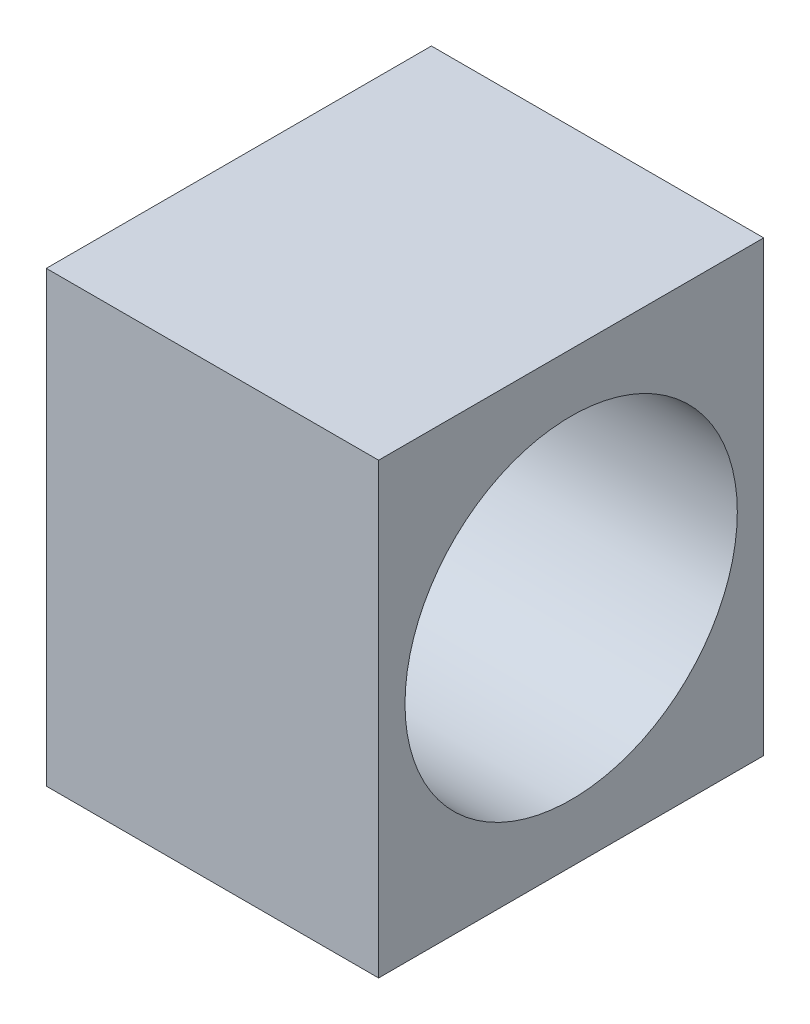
SolidWorks part; units mm, degrees
ref_plane "Front Plane" through (0, 0, 0) normal (0, 0, 1) x (1, 0, 0)
ref_plane "Top Plane" through (0, 0, 0) normal (0, 1, 0) x (1, 0, 0)
ref_plane "Right Plane" through (0, 0, 0) normal (1, 0, 0) x (0, 0, -1)
sketch "Sketch1" plane through (0, 0, 0) normal (0, 0, 1) x (1, 0, 0)
  line L1 (-27.636, 161.5249) -> (7.364, 161.5249)
  line L2 (-27.636, 161.5249) -> (-27.636, 208.7542)
  line L3 (-27.636, 208.7542) -> (7.364, 208.7542)
  line L4 (7.364, 161.5249) -> (7.364, 208.7542)
  dimension "D1" = 35
  dimension "D2" = 47.2292
extrude "Boss-Extrude1" add sketch "Sketch1" along normal blind 40.5607
sketch "Sketch2" plane through (7.364, 0, 0) normal (1, 0, 0) x (0, 0, -1)
  line L0 (-40.5607, 208.7542) -> (0, 161.5249) construction
  circle A0 centre (-20.2803, 185.1395) radius 17.5
  dimension "D1" = 35
extrude "Cut-Extrude1" cut sketch "Sketch2" against normal blind 41.6
